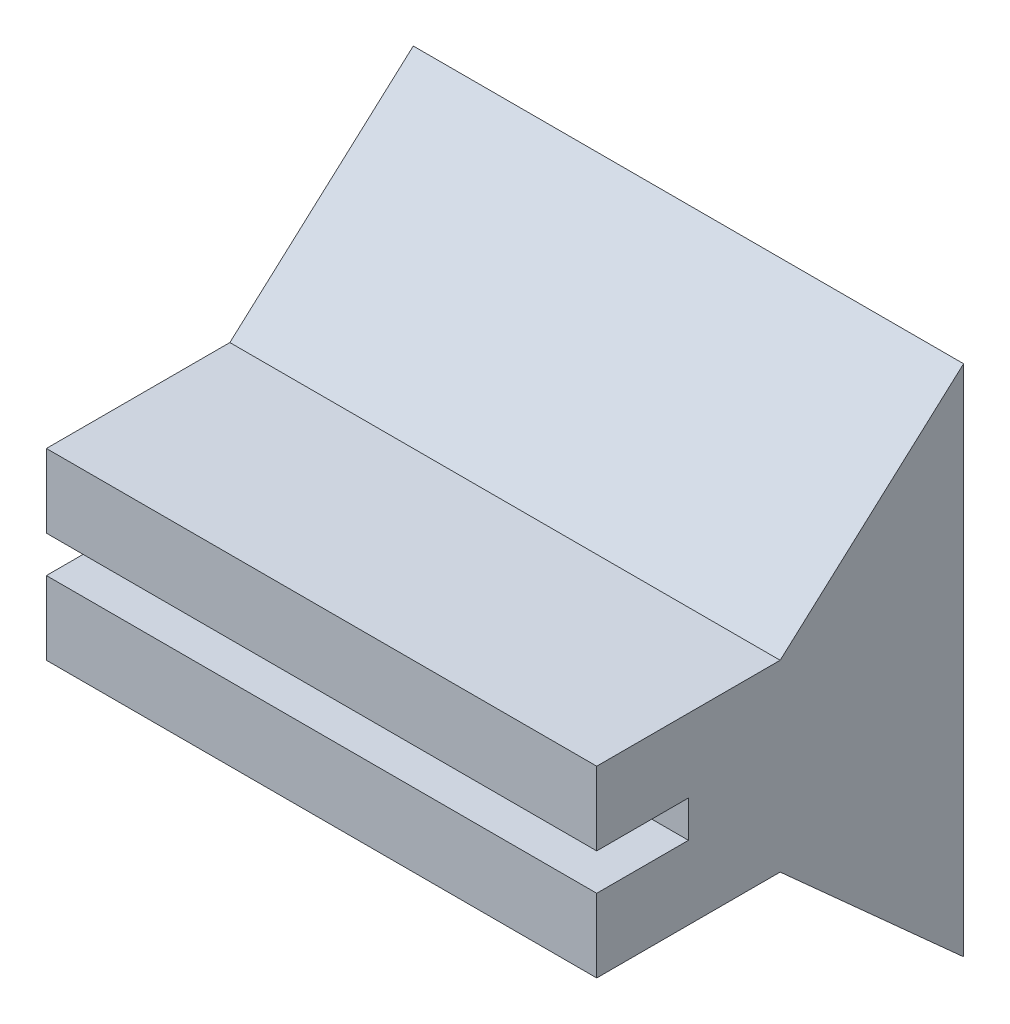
SolidWorks part; units mm, degrees
ref_plane "Front Plane" through (0, 0, 0) normal (0, 0, 1) x (1, 0, 0)
ref_plane "Top Plane" through (0, 0, 0) normal (0, 1, 0) x (1, 0, 0)
ref_plane "Right Plane" through (0, 0, 0) normal (1, 0, 0) x (0, 0, -1)
sketch "Sketch1" plane through (0, 0, 0) normal (0, 0, 1) x (1, 0, 0)
  line L1 (-15, -5) -> (15, -5)
  line L2 (-15, -5) -> (-15, 5)
  line L3 (-15, 5) -> (15, 5)
  line L4 (15, -5) -> (15, 5)
  line L5 (-15, -5) -> (15, 5) construction
  line L6 (-15, 5) -> (15, -5) construction
  point P0 (0, 0)
  dimension "D1" = 30
  dimension "D2" = 10
extrude "Boss-Extrude1" add sketch "Sketch1" along normal blind 20
sketch "Sketch2" plane through (0, 0, 20) normal (0, 0, 1) x (1, 0, 0)
  line L0 (15, -5) -> (15, 5) construction
  line L1 (-15, -1) -> (15, -1)
  line L2 (-15, -1) -> (-15, 1)
  line L3 (-15, 1) -> (15, 1)
  line L4 (15, -1) -> (15, 1)
  line L5 (-15, -1) -> (15, 1) construction
  line L6 (-15, 1) -> (15, -1) construction
  point P0 (0, 0)
  dimension "D1" = 2
extrude "Cut-Extrude1" cut sketch "Sketch2" against normal blind 5
sketch "Sketch3" plane through (-15, 0, 0) normal (-1, 0, 0) x (0, 0, 1)
  line L0 (0, -5) -> (0, -14)
  line L1 (0, -14) -> (10, -5)
  line L2 (20, -5) -> (0, -5) construction
  line L3 (10, -5) -> (0, -5)
  line L4 (0, 0) -> (7.5167, 0) construction
  line L5 (0, -5) -> (0, 5) construction
  line L6 (10, 5) -> (0, 5)
  line L7 (0, 14) -> (10, 5)
  line L8 (0, 5) -> (0, 14)
  dimension "D1" = 9
extrude "Boss-Extrude2" add sketch "Sketch3" against normal blind 30
